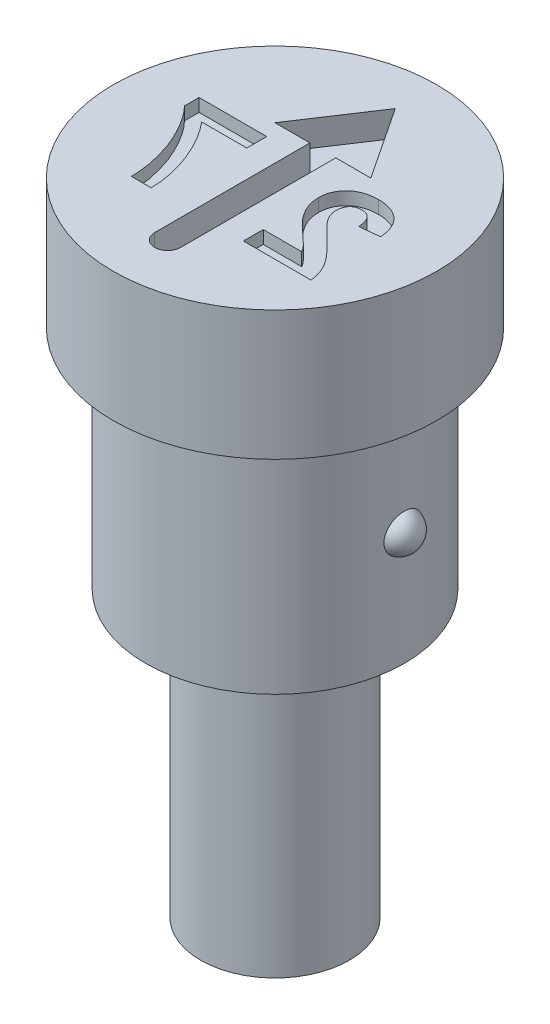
SolidWorks part; units mm, degrees
ref_plane "Front Plane" through (0, 0, 0) normal (0, 0, 1) x (1, 0, 0)
ref_plane "Top Plane" through (0, 0, 0) normal (0, 1, 0) x (1, 0, 0)
ref_plane "Right Plane" through (0, 0, 0) normal (1, 0, 0) x (0, 0, -1)
sketch "Sketch1" plane through (0, 0, 0) normal (0, 0, 1) x (1, 0, 0)
  line L0 (0, 0) -> (0, -9.9) construction
  line L1 (0, -2.75) -> (0, 2.75) construction
  line L2 (0, 0) -> (-2.5, 0)
  line L3 (-2.5, 0) -> (-2.5, -2)
  line L4 (-2.5, -2) -> (-2, -2)
  line L5 (-2, -2) -> (-2, -5.5)
  line L6 (-2, -5.5) -> (-1.15, -5.5)
  line L7 (-1.15, -5.5) -> (-1.15, -9.9)
  line L8 (-1.15, -9.9) -> (0, -9.9)
  line L9 (0, -9.9) -> (0, 0)
  dimension "D1" = 5
  dimension "D2" = 9.9
  dimension "D3" = 2
  dimension "D4" = 5.5
  dimension "D5" = 4
  dimension "D6" = 2.3
revolve "Revolve1" add sketch "Sketch1" angle 360 about L0
sketch "Sketch3" plane through (0, 0, 0) normal (0, 1, 0) x (1, 0, 0)
  line L0 (0, 1.86) -> (-0.7413, 0.74)
  line L1 (-0.7413, 0.74) -> (-0.2, 0.74)
  line L2 (-0.2, 0.74) -> (-0.2, -1.66)
  line L3 (0.2, -1.66) -> (0.2, 0.74)
  line L4 (0.2, 0.74) -> (0.7413, 0.74)
  line L5 (0.7413, 0.74) -> (0, 1.86)
  line L6 (0, 1.86) -> (0, -1.86) construction
  arc A0 (-0.2, -1.66) -> (0.2, -1.66) centre (0, -1.66) ccw
  dimension "D3" = 0.2
  dimension "D1" = 1.12
  dimension "D2" = 67
  dimension "D4" = 3.52
extrude "Cut-Extrude1" cut sketch "Sketch3" against normal blind 0.4
sketch "Sketch4" plane through (0, 0, 0) normal (0, 1, 0) x (1, 0, 0)
  text T0 "27" font "Arial" height 1.6
extrude "Cut-Extrude2" cut sketch "Sketch4" against normal blind 0.2
sketch "Sketch5" plane through (0, 0, 0) normal (0, 0, 1) x (1, 0, 0)
  line L2 (1.9174, -3.45) -> (1.9174, -4.05)
  line L3 (1.9174, -3.45) -> (1.9174, -4.05) construction
  line L4 (-2, -3.75) -> (1.9174, -3.75) construction
  line L5 (-2, -2) -> (-2, -5.5) construction
  arc A1 (1.9174, -4.05) -> (1.9174, -3.45) centre (1.9174, -3.75) ccw
  dimension "D1" = 0.3
revolve "Revolve2" add sketch "Sketch5" angle 360 about L2
